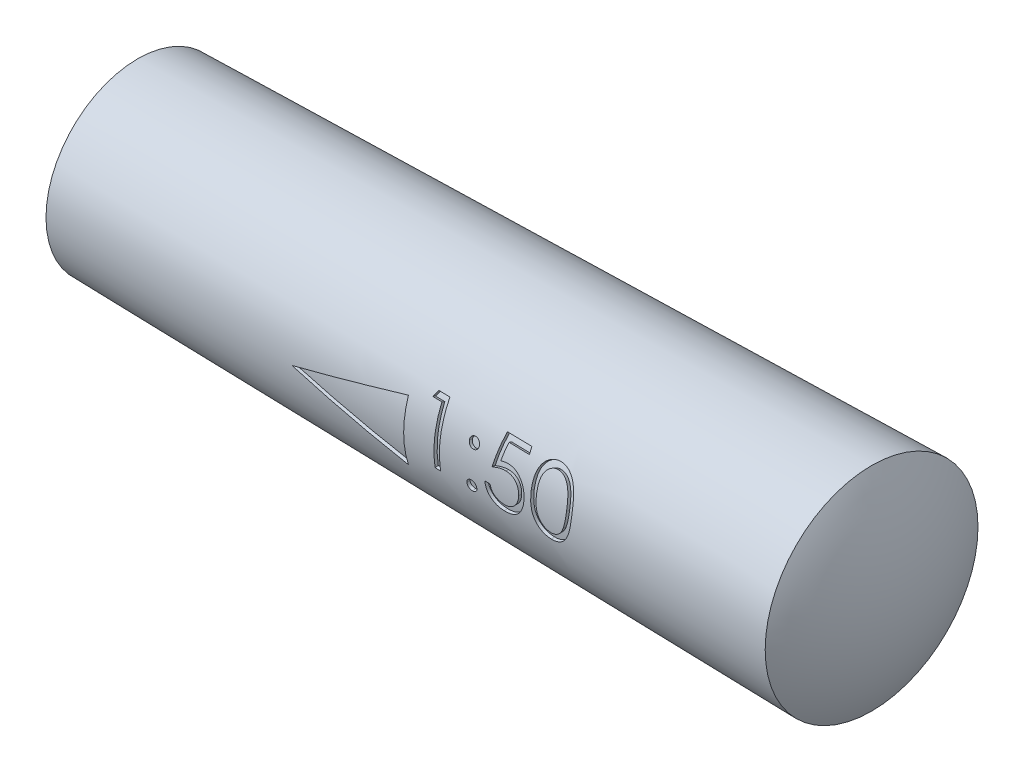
SolidWorks part; units mm, degrees
ref_plane "Front Plane" through (0, 0, 0) normal (0, 0, 1) x (1, 0, 0)
ref_plane "Top Plane" through (0, 0, 0) normal (0, 1, 0) x (1, 0, 0)
ref_plane "Right Plane" through (0, 0, 0) normal (1, 0, 0) x (0, 0, -1)
sketch "Sketch1" plane through (0, 0, 0) normal (1, 0, 0) x (0, 0, -1)
  circle A0 centre (0, 0) radius 1.5
  dimension "D1" = 3
extrude "Extrude1" add sketch "Sketch1" along normal mid plane 12
draft "Draft1" type of draft neutral plane draft angle 1.146 faces to draft 1 parameters "D1"=1.146
sketch "Sketch2" plane through (0, 0, 0) normal (0, 0, 1) x (1, 0, 0)
  line L0 (-6, 0) -> (-6, 1.5)
  line L1 (-6, 1.5) -> (-6, -1.5) construction
  line L2 (-6, 0) -> (-6.45, 0)
  line L3 (-6.45, 0) -> (-6.45, -1.62) construction
  line L4 (6, 0) -> (6, 1.74)
  line L5 (6, -1.74) -> (6, 1.74) construction
  line L6 (6, 0) -> (6.45, 0)
  line L7 (6.45, 0) -> (6.45, -1.62) construction
  line L8 (-6, -1.5) -> (6, -1.74) construction
  arc A0 (-6.45, 0) -> (-6, 1.5) centre (-3.725, 0) cw
  arc A1 (6.45, 0) -> (6, 1.74) centre (2.861, 0) ccw
  point P14 (0, -1.62)
revolve "Revolve1" add sketch "Sketch2" angle 360 about L2
sketch "Sketch5" plane through (0, 0, 0) normal (0, 0, 1) x (1, 0, 0)
  line L0 (0, 1.62) -> (0, -1.62) construction
  line L1 (6, 1.74) -> (-6, 1.5) construction
  line L2 (-6, -1.5) -> (6, -1.74) construction
ref_plane "Plane2" through (0, 0, 0) normal (-0.02, 0, 0.9998) x (0.9998, 0, 0.02)
sketch "Sketch6" plane through (0, 0, 0) normal (-0.02, 0, 0.9998) x (0.9998, 0, 0.02)
  line L0 (0, 0) -> (0, 0.5)
  line L1 (0, 1.62) -> (0, -1.62) construction
  line L2 (0, 0.5) -> (-1.866, 0)
  line L3 (-1.866, 0) -> (0, -0.5)
  line L4 (0, -0.5) -> (0, 0)
  line L5 (0, -0.25) -> (3, -0.25) construction
  text T0 "1:50" font "Century Gothic" height 1
  dimension "D1" = 1
  dimension "D2" = 30
  dimension "D3" = 3
wrap "Wrap2" sketch "Sketch6" wrap type deboss source sketch "Sketch6" thickness 0.05 parameters "D1"=0.05
equation "\"D2@Sketch2\" = \"D1@Sketch2\""
